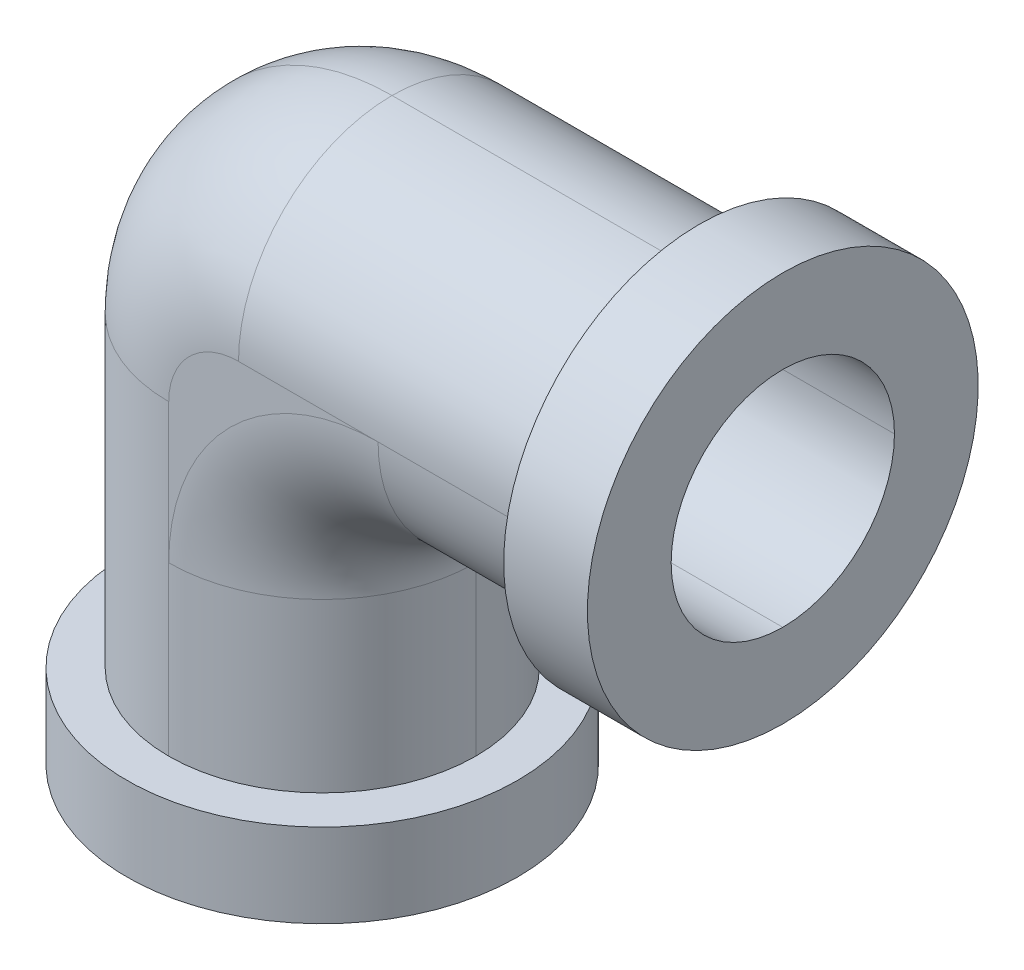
SolidWorks part; units mm, degrees
ref_plane "Alzado" through (0, 0, 0) normal (0, 0, 1) x (1, 0, 0)
ref_plane "Planta" through (0, 0, 0) normal (0, 1, 0) x (1, 0, 0)
ref_plane "Vista lateral" through (0, 0, 0) normal (1, 0, 0) x (0, 0, -1)
sketch "Croquis1" plane through (0, 0, 0) normal (0, 0, 1) x (1, 0, 0)
  line L0 (0, 0) -> (0, 14)
  line L1 (8, 22) -> (22, 22)
  line L2 (22, 22) -> (22, 11)
  line L3 (22, 11) -> (13, 11)
  line L4 (11, 9) -> (11, 0)
  line L5 (11, 0) -> (0, 0)
  arc A0 (0, 14) -> (8, 22) centre (8, 14) cw
  arc A1 (13, 11) -> (11, 9) centre (13, 9) ccw
  point P9 (0, 22)
  dimension "D5" = 8
  dimension "D6" = 2
  dimension "D1" = 11
  dimension "D2" = 11
  dimension "D3" = 22
  dimension "D4" = 22
extrude "Saliente-Extruir1" add sketch "Croquis1" along normal blind 11
fillet "Redondeo1" radius 5.5 12 edges at (11, 4.5, 0) (11.5858, 10.4142, 0) (11, 4.5, 11) (11.5858, 10.4142, 11) (0, 7, 0) (2.3431, 19.6569, 0) (0, 7, 11) (2.3431, 19.6569, 11) (17.5, 11, 0) (17.5, 11, 11) (15, 22, 0) (15, 22, 11)
shell "Vaciado1" thickness 1.5
sketch "Croquis2" plane through (0, 0, 0) normal (0, -1, 0) x (1, 0, 0)
  circle A0 centre (5.5, 5.5) radius 4
  arc A2 (5.5, 0) -> (11, 5.5) centre (5.5, 5.5) ccw construction
  dimension "D1" = 8
extrude "Cortar-Extruir1" cut sketch "Croquis2" against normal up to next
sketch "Croquis3" plane through (22, 0, 0) normal (1, 0, 0) x (0, 0, -1)
  circle A0 centre (-5.5, 16.5) radius 5.5
  circle A1 centre (-5.5, 16.5) radius 7
  arc A2 (0, 16.5) -> (-5.5, 22) centre (-5.5, 16.5) ccw construction
  dimension "D1" = 1.5
extrude "Saliente-Extruir2" add sketch "Croquis3" against normal blind 3
sketch "Croquis4" plane through (0, 0, 0) normal (0, -1, 0) x (1, 0, 0)
  circle A0 centre (5.5, 5.5) radius 5.5
  arc A1 (5.5, 11) -> (0, 5.5) centre (5.5, 5.5) ccw construction
  circle A2 centre (5.5, 5.5) radius 7
  dimension "D1" = 1.5
extrude "Saliente-Extruir3" add sketch "Croquis4" against normal blind 3
